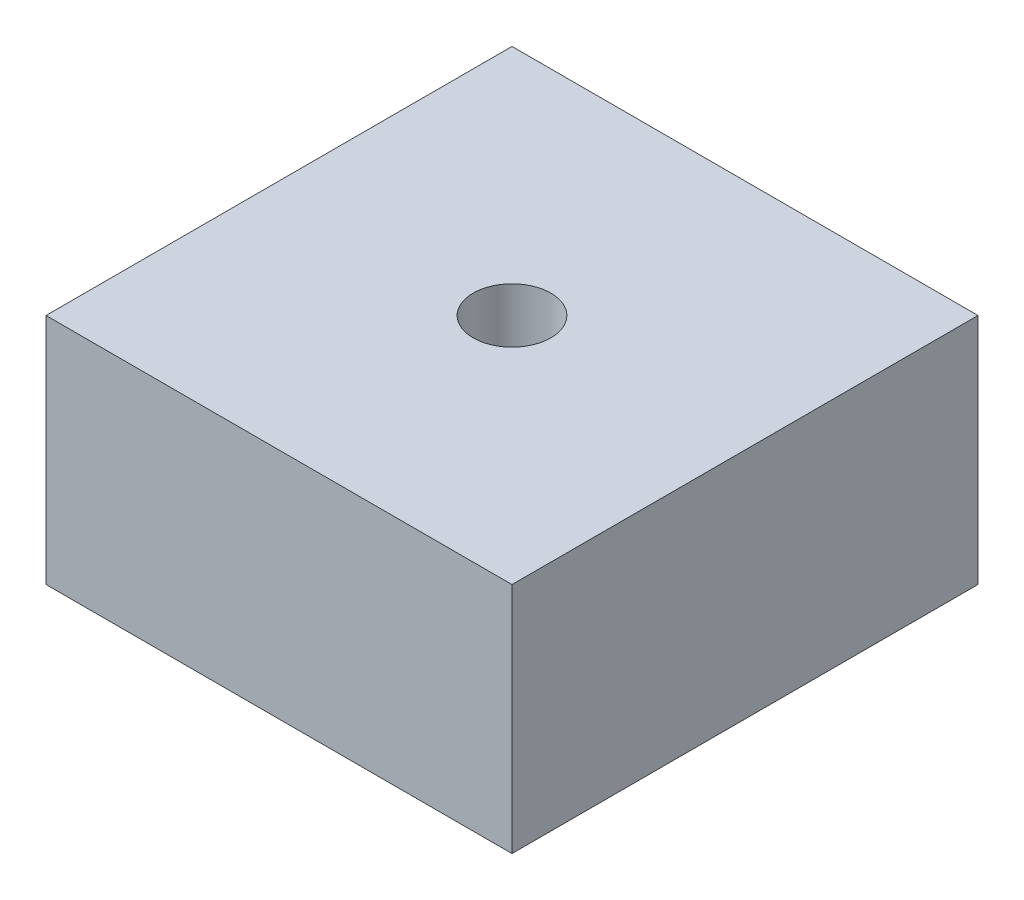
SolidWorks part; units mm, degrees
ref_plane "Front Plane" through (0, 0, 0) normal (0, 0, 1) x (1, 0, 0)
ref_plane "Top Plane" through (0, 0, 0) normal (0, 1, 0) x (1, 0, 0)
ref_plane "Right Plane" through (0, 0, 0) normal (1, 0, 0) x (0, 0, -1)
sketch "Sketch1" plane through (0, 0, 0) normal (0, 1, 0) x (1, 0, 0)
  line L1 (-19.05, -19.05) -> (19.05, -19.05)
  line L2 (-19.05, -19.05) -> (-19.05, 19.05)
  line L3 (-19.05, 19.05) -> (19.05, 19.05)
  line L4 (19.05, -19.05) -> (19.05, 19.05)
  line L5 (-19.05, -19.05) -> (19.05, 19.05) construction
  line L6 (-19.05, 19.05) -> (19.05, -19.05) construction
  point P0 (0, 0)
  dimension "D1" = 38.1
extrude "Boss-Extrude1" add sketch "Sketch1" along normal blind 19.05
sketch "Sketch2" plane through (0, 19.05, 0) normal (0, 1, 0) x (1, 0, 0)
  circle A0 centre (0, 0) radius 3.175
  dimension "D1" = 6.35
extrude "Cut-Extrude1" cut sketch "Sketch2" against normal through all
